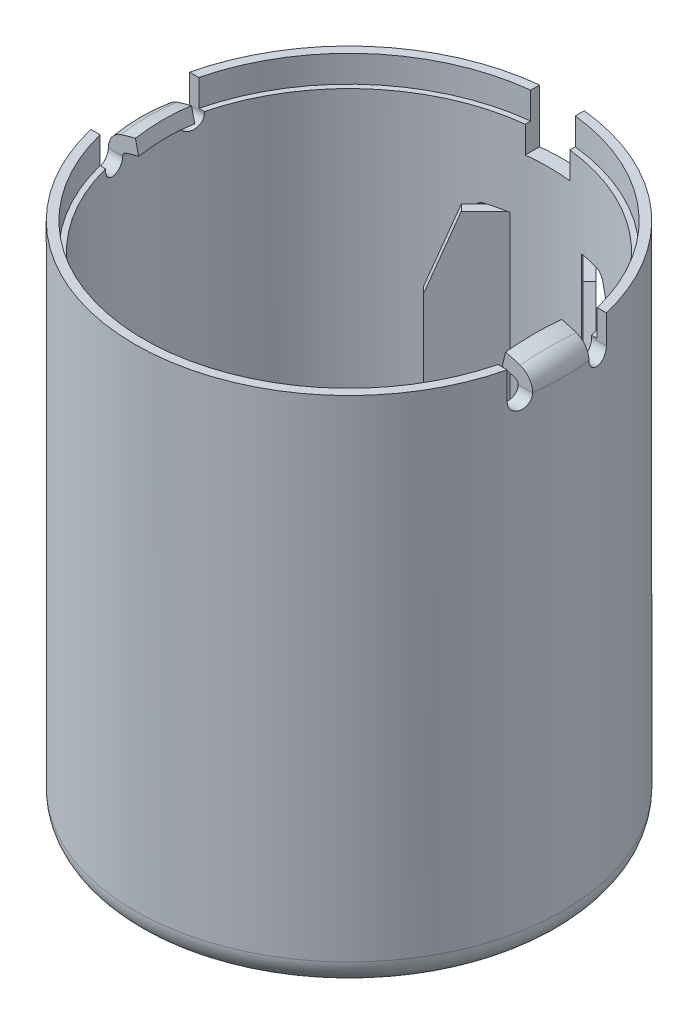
SolidWorks part; units mm, degrees
ref_plane "Plan1" through (0, 0, 0) normal (0, 0, 1) x (1, 0, 0)
ref_plane "Plan2" through (0, 0, 0) normal (0, 1, 0) x (1, 0, 0)
ref_plane "Plan3" through (0, 0, 0) normal (1, 0, 0) x (0, 0, -1)
sketch "Esquisse1" plane through (0, 0, 0) normal (0, 0, 1) x (1, 0, 0)
  line L0 (0, -0.9) -> (0, 78.6) construction
  line L1 (-3, 0) -> (-3, 1.6)
  line L2 (-3, 1.6) -> (-10.5, 1.6)
  line L3 (-12, 3.1) -> (-12, 30.6)
  line L4 (-11.2, 3.4) -> (-11.2, 29.1)
  line L5 (-2.5, 2.4) -> (-10.2, 2.4)
  line L7 (-2.5, 0) -> (-3, 0)
  line L8 (-12, 30.6) -> (-11.5, 30.6)
  line L9 (-2.5, 2.4) -> (-2.5, 0)
  line L11 (-11.5, 30.6) -> (-11.5, 29.1)
  line L12 (-11.5, 29.1) -> (-11.2, 29.1)
  arc A0 (-10.2, 2.4) -> (-11.2, 3.4) centre (-10.2, 3.4) cw
  arc A1 (-12, 3.1) -> (-10.5, 1.6) centre (-10.5, 3.1) ccw
  point P15 (-12, 1.6)
  dimension "D6" = 1
  dimension "D7" = 1.5
  dimension "D2" = 12
  dimension "D3" = 1.6
  dimension "D4" = 29
  dimension "D10" = 0.5
  dimension "D12" = 0.5
  dimension "D13" = 1.5
  dimension "D14" = 3
  dimension "D5" = 0.8
revolve "Base-Révolution" add sketch "Esquisse1" angle 180 about L0
sketch "Esquisse3" plane through (0, 1.6, 0) normal (0, -1, 0) x (1, 0, 0)
  line L2 (0, 0) -> (0, 17) construction
  line L3 (0, 0) -> (-18, 0) construction
  circle A4 centre (0, 7) radius 1.15
  dimension "D5" = 2.3
  dimension "D6" = 14
extrude "Enlèv. mat.-Extru.3" cut sketch "Esquisse3" against normal through all
mirror "Bossage-Symétrie1"
sketch "Esquisse6" plane through (0, 0, 0) normal (0, 0, 1) x (1, 0, 0)
  line L0 (2, 24.5) -> (2, 14.5)
  line L1 (2, 14.5) -> (4.5, 14.5)
  line L2 (5, 15) -> (5, 20.4093)
  line L3 (4.9682, 20.5849) -> (3.6217, 24.1756)
  line L4 (3.1535, 24.5) -> (2, 24.5)
  line L5 (0, 0) -> (0, 32.0156) construction
  line L7 (-3.1535, 24.5) -> (-2, 24.5)
  line L8 (-4.9682, 20.5849) -> (-3.6217, 24.1756)
  line L9 (-5, 15) -> (-5, 20.4093)
  line L10 (-2, 14.5) -> (-4.5, 14.5)
  line L11 (-2, 24.5) -> (-2, 14.5)
  arc A0 (3.6217, 24.1756) -> (3.1535, 24.5) centre (3.1535, 24) ccw
  arc A1 (5, 20.4093) -> (4.9682, 20.5849) centre (4.5, 20.4093) ccw
  arc A2 (4.5, 14.5) -> (5, 15) centre (4.5, 15) ccw
  arc A3 (-4.5, 14.5) -> (-5, 15) centre (-4.5, 15) cw
  arc A4 (-5, 20.4093) -> (-4.9682, 20.5849) centre (-4.5, 20.4093) cw
  arc A5 (-3.6217, 24.1756) -> (-3.1535, 24.5) centre (-3.1535, 24) cw
  point P12 (3.5, 24.5)
  point P15 (5, 20.5)
  point P18 (5, 14.5)
  dimension "D7" = 0.5
  dimension "D8" = 0.5
  dimension "D9" = 0.5
  dimension "D1" = 10
  dimension "D3" = 2
  dimension "D4" = 5
  dimension "D5" = 6
  dimension "D6" = 1.5
extrude "Enlèv. mat.-Extru.6" cut sketch "Esquisse6" against normal through all
ref_plane "Plan4" through (-6.9161, 0, -6.9161) normal (0.7071, 0, 0.7071) x (0.7071, 0, -0.7071)
sketch "Esquisse8" plane through (-6.9161, 0, -6.9161) normal (0.7071, 0, 0.7071) x (0.7071, 0, -0.7071)
  line L0 (6.9524, 14.5) -> (6.9524, 24.5)
  line L1 (6.9524, 24.5) -> (4.4524, 24.5)
  line L2 (4.4524, 24.5) -> (2.9524, 20.5)
  line L3 (2.9524, 20.5) -> (2.9524, 14.5)
  line L4 (2.9524, 14.5) -> (6.9524, 14.5)
  line L6 (6.9524, 14.5) -> (6.9524, 24.5) construction
  dimension "D1" = 4
  dimension "D2" = 2.5
  dimension "D3" = 10
  dimension "D4" = 10
  dimension "D5" = 4
  dimension "D6" = 6
extrude "Boss.-Extru.2" add sketch "Esquisse8" along normal blind 0.5
ref_plane "Plan5" through (6.9161, 0, -6.9161) normal (-0.7071, 0, 0.7071) x (0.7071, 0, 0.7071)
sketch "Esquisse9" plane through (6.9161, 0, -6.9161) normal (-0.7071, 0, 0.7071) x (0.7071, 0, 0.7071)
  line L0 (-6.9524, 24.5) -> (-6.9524, 14.5)
  line L1 (-6.9524, 14.5) -> (-2.9524, 14.5)
  line L7 (-2.9524, 20.8115) -> (-2.9524, 14.5)
  line L8 (-4.4524, 24.5) -> (-2.9524, 20.8115)
  line L9 (-6.9524, 24.5) -> (-4.4524, 24.5)
  dimension "D1" = 10
  dimension "D2" = 10
  dimension "D3" = 4
  dimension "D4" = 4
  dimension "D5" = 2.5
extrude "Boss.-Extru.3" add sketch "Esquisse9" along normal blind 0.5
fillet "Congé8" radius 1 1 edges
fillet "Congé9" radius 1 1 edges at (-2, 19.5, -11.8322)
sketch "Esquisse13" plane through (0, 0, 0) normal (0, 0, 1) x (1, 0, 0)
  line L0 (0, 27.6) -> (0, 30.6)
  line L1 (11.5, 30.6) -> (-11.5, 30.6) construction
  dimension "D1" = 3
extrude "Enlèv. de mat.-Extru.-Mince1" cut sketch "Esquisse13" along normal blind 1 and the other way up to next thin
sketch "Esquisse16" plane through (0, 0, 0) normal (1, 0, 0) x (0, 0, -1)
  line L0 (0, 29) -> (0, 30.6)
  line L1 (11.4319, 30.6) -> (-11.5, 30.6) construction
  line L2 (2.7468, 29) -> (2.7468, 30.6)
  line L3 (-2.7998, 29) -> (-2.7998, 30.6)
  line L4 (2.7468, 30.6) -> (-2.7998, 30.6)
  line L5 (1.5468, 29) -> (-1.5998, 29)
  arc A0 (2.7468, 29) -> (1.5468, 29) centre (2.1468, 29) cw
  arc A1 (-2.7998, 29) -> (-1.5998, 29) centre (-2.1998, 29) ccw
  dimension "D2" = 0.6
  dimension "D3" = 0.6
  dimension "D1" = 1.6
extrude "Enlèv. mat.-Extru.7" cut sketch "Esquisse16" against normal through all and the other way through all contours A0 L2 L4 L0 L5 | L3 A1 L5 L0 L4
ref_plane "Plan6" through (0, 0, 1.5998) normal (0, 0, 1) x (1, 0, 0)
sketch "Esquisse19" plane through (0, 0, 1.5998) normal (0, 0, 1) x (1, 0, 0)
  line L0 (-11.8929, 29) -> (-11.8929, 28.2671) construction
  arc A0 (-11.8929, 29) -> (-11.1852, 29.9876) centre (-10.85, 29) cw
  arc A1 (-11.1852, 29.9876) -> (-10.3725, 30.2187) centre (-8.4782, 22.0123) cw
sketch3d "Esquisse3D1"
  line L1 (-11.8999, 29, -1.5468) -> (-11.0927, 29, -1.5468)
  line L2 (-11.8929, 29, 1.5998) -> (-11.0852, 29, 1.5998)
  arc A0 (-11.8929, 29, 1.5998) -> (-11.8999, 29, -1.5468) centre (0, 29, 0) cw
  arc A2 (-11.0927, 29, -1.5468) -> (-11.0852, 29, 1.5998) centre (0, 29, 0) cw
  point P2 (0, 17, 0)
  point P8 (0, 40.2, 0)
sweep "Balayage1" add profiles "Esquisse3D1" path "Esquisse19"
sketch "Esquisse20" plane through (0, 1.6, 0) normal (0, -1, 0) x (1, 0, 0)
  line L1 (8.5, 1.3) -> (10, 1.3)
  line L2 (8.5, 1.3) -> (8.5, -1.3)
  line L3 (8.5, -1.3) -> (10, -1.3)
  line L4 (10, 1.3) -> (10, -1.3)
  dimension "D1" = 10
  dimension "D2" = 1.5
  dimension "D3" = 1.3
  dimension "D4" = 1.3
extrude "Enlèv. mat.-Extru.8" cut sketch "Esquisse20" against normal through all
sketch "Esquisse21" plane through (10, 0, 0) normal (-1, 0, 0) x (0, 0, 1)
  line L0 (1.3, 1.6) -> (0.8, 2.1)
  line L1 (0.8, 2.1) -> (-0.8, 2.1)
  line L2 (-0.8, 2.1) -> (-1.3, 1.6)
  line L3 (-1.3, 1.6) -> (1.3, 1.6) construction
  dimension "D1" = 0.5
  dimension "D2" = 45
  dimension "D3" = 45
extrude "Extru.-Mince1" add sketch "Esquisse21" along normal blind 1.5 thin
mirror "Symétrie1" about plane through (0, 0, 0) normal (1, 0, 0) of "Extru.-Mince1", "Balayage1", "Enlèv. mat.-Extru.8"
fillet "Congé10" radius 0.6 4 edges at (9.25, 1.6, -1.3) (9.25, 1.6, 1.3) (-9.25, 1.6, 1.3) (-9.25, 1.6, -1.3)
fillet "Congé11" radius 0.05 5 edges at (0, 1.6, -3) (9.25, 2.1, -0.8) (9.25, 2.1, 0.8) (-9.25, 2.1, -0.8) (-9.25, 2.1, 0.8)
